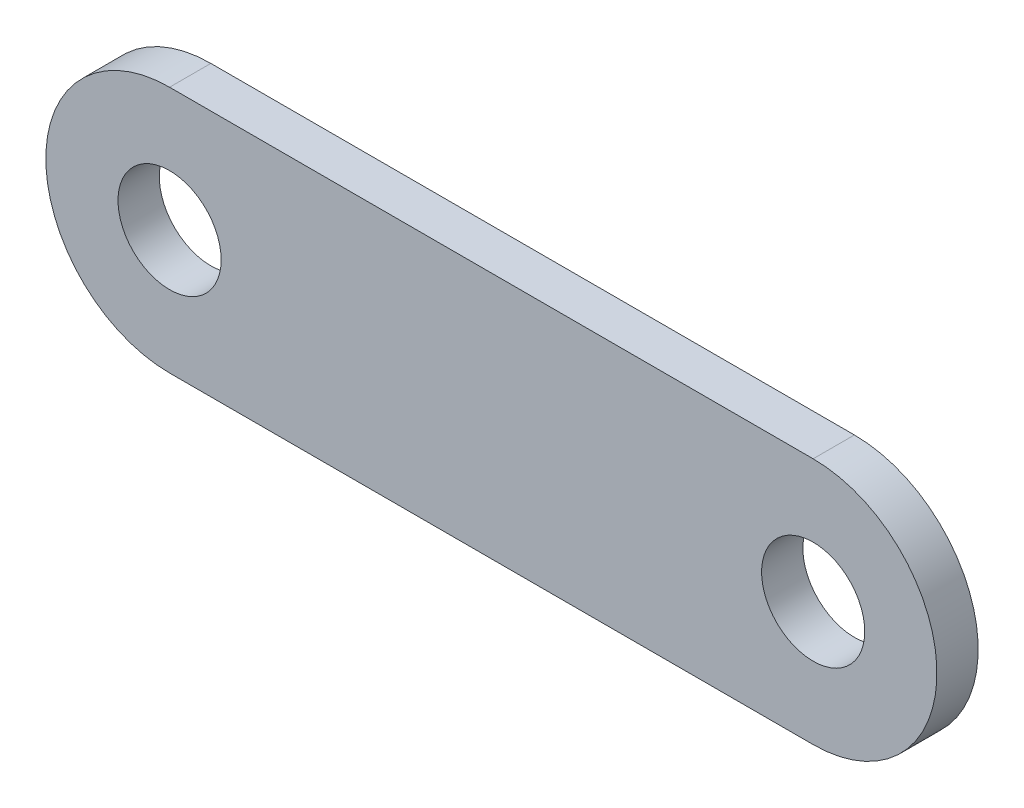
SolidWorks part; units mm, degrees
ref_plane "Front Plane" through (0, 0, 0) normal (0, 0, 1) x (1, 0, 0)
ref_plane "Top Plane" through (0, 0, 0) normal (0, 1, 0) x (1, 0, 0)
ref_plane "Right Plane" through (0, 0, 0) normal (1, 0, 0) x (0, 0, -1)
sketch "Sketch1" plane through (0, 0, 0) normal (0, 0, 1) x (1, 0, 0)
  line L0 (0, 7.62) -> (39.624, 7.62)
  line L1 (0, -7.62) -> (39.624, -7.62)
  line L2 (-35.087, 0) -> (62.6596, 0) construction
  circle A0 centre (0, 0) radius 3.175
  circle A1 centre (39.624, 0) radius 3.175
  arc A2 (39.624, 7.62) -> (39.624, -7.62) centre (39.624, 0) cw
  arc A3 (0, 7.62) -> (0, -7.62) centre (0, 0) ccw
  dimension "D2" = 6.35
  dimension "D1" = 39.624
  dimension "D3" = 15.24
extrude "Extrude1" add sketch "Sketch1" along normal blind 2.54
sketch3d "3DSketch1"
  circle A0 centre (0, 0, 2.54) radius 3.175 construction
  circle A1 centre (0, 0, 0) radius 3.175 construction
  circle A2 centre (39.624, 0, 0) radius 3.175 construction
  circle A3 centre (39.624, 0, 2.54) radius 3.175 construction
  point P0 (0, 0, 2.54)
  point P1 (0, 0, 0)
  point P2 (39.624, 0, 2.54)
  point P3 (39.624, 0, 0)
  point P6 (0, 0, 5.715)
  point P9 (0, 0, 3.175)
  point P12 (39.624, 0, 3.175)
  point P15 (39.624, 0, 5.715)
